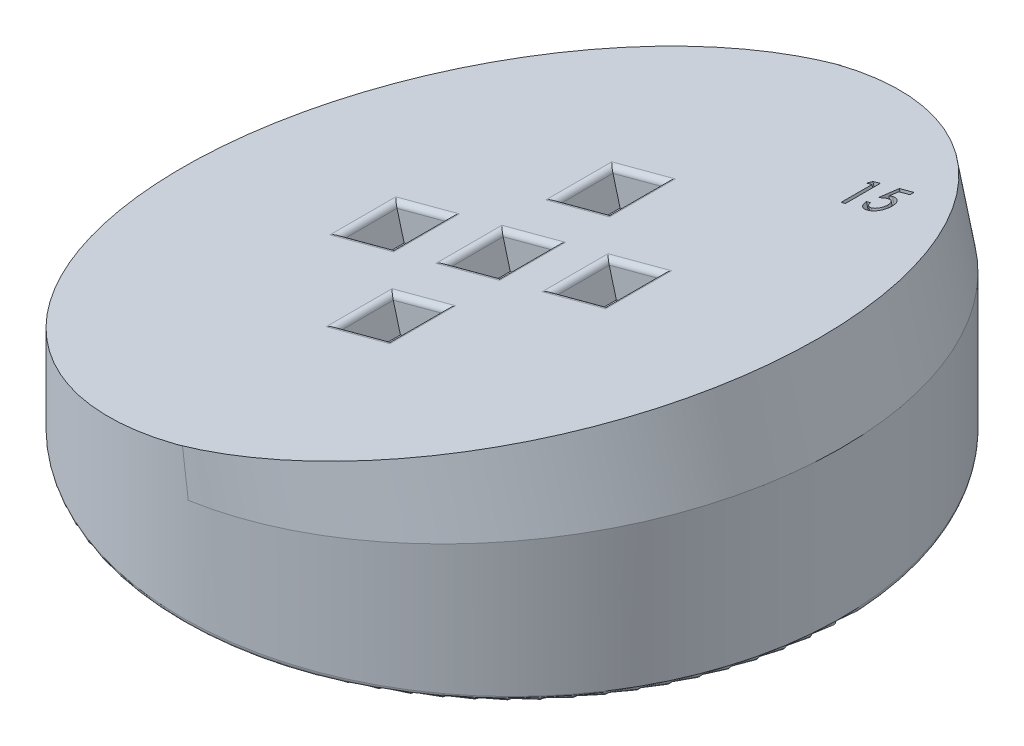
SolidWorks part; units mm, degrees
ref_plane "Front Plane" through (0, 0, 0) normal (0, 0, 1) x (1, 0, 0)
ref_plane "Top Plane" through (0, 0, 0) normal (0, 1, 0) x (1, 0, 0)
ref_plane "Right Plane" through (0, 0, 0) normal (1, 0, 0) x (0, 0, -1)
sketch "Sketch1" plane through (0, 0, 0) normal (0, 1, 0) x (1, 0, 0)
  circle A0 centre (0, 0) radius 30
extrude "Boss-Extrude1" add sketch "Sketch1" along normal blind 50
sketch "Sketch3" plane through (0, 50, 0) normal (0, 1, 0) x (1, 0, 0)
sketch "Sketch4" plane through (0, 0, 0) normal (0, -1, 0) x (-1, 0, 0)
  line L0 (0, 0) -> (-10, 0) construction
  line L1 (0, 0) -> (0, -10) construction
  line L2 (0, 0) -> (0, 10) construction
  line L3 (0, 0) -> (10, 0) construction
  line L5 (-2.5, 2.5) -> (2.5, 2.5)
  line L6 (-2.5, 2.5) -> (-2.5, -2.5)
  line L7 (-2.5, -2.5) -> (2.5, -2.5)
  line L8 (2.5, 2.5) -> (2.5, -2.5)
  line L9 (-2.5, 2.5) -> (2.5, -2.5) construction
  line L10 (-2.5, -2.5) -> (2.5, 2.5) construction
  line L11 (-2.5, -7.5) -> (2.5, -7.5)
  line L12 (-2.5, -7.5) -> (-2.5, -12.5)
  line L13 (-2.5, -12.5) -> (2.5, -12.5)
  line L14 (2.5, -7.5) -> (2.5, -12.5)
  line L15 (-2.5, -7.5) -> (2.5, -12.5) construction
  line L16 (-2.5, -12.5) -> (2.5, -7.5) construction
  line L17 (7.5, 2.5) -> (12.5, 2.5)
  line L18 (7.5, 2.5) -> (7.5, -2.5)
  line L19 (7.5, -2.5) -> (12.5, -2.5)
  line L20 (12.5, 2.5) -> (12.5, -2.5)
  line L21 (7.5, 2.5) -> (12.5, -2.5) construction
  line L22 (7.5, -2.5) -> (12.5, 2.5) construction
  line L23 (-12.5, 2.5) -> (-7.5, 2.5)
  line L24 (-12.5, 2.5) -> (-12.5, -2.5)
  line L25 (-12.5, -2.5) -> (-7.5, -2.5)
  line L26 (-7.5, 2.5) -> (-7.5, -2.5)
  line L27 (-12.5, 2.5) -> (-7.5, -2.5) construction
  line L28 (-12.5, -2.5) -> (-7.5, 2.5) construction
  line L29 (2.5, 7.5) -> (-2.5, 7.5)
  line L30 (2.5, 7.5) -> (2.5, 12.5)
  line L31 (2.5, 12.5) -> (-2.5, 12.5)
  line L32 (-2.5, 7.5) -> (-2.5, 12.5)
  line L33 (2.5, 7.5) -> (-2.5, 12.5) construction
  line L34 (2.5, 12.5) -> (-2.5, 7.5) construction
  dimension "D1" = 5
  dimension "D2" = 5
  dimension "D3" = 5
  dimension "D4" = 5
  dimension "D5" = 5
  dimension "D6" = 5
extrude "Cut-Extrude2" cut sketch "Sketch4" against normal blind 3
fillet "Fillet2" radius 0.5 21 edges at (0, 0, 30) (2.5, 0, 0) (0, 0, 2.5) (-2.5, 0, 0) (0, 0, -2.5) (2.5, 0, 10) (0, 0, 12.5) (-2.5, 0, 10) (0, 0, 7.5) (-7.5, 0, 0) (-10, 0, 2.5) (-12.5, 0, 0) (-10, 0, -2.5) (12.5, 0, 0) (10, 0, 2.5) (7.5, 0, 0) (10, 0, -2.5) (-2.5, 0, -10) (0, 0, -12.5) (2.5, 0, -10) (0, 0, -7.5)
ref_plane "Plane6" through (0, 0, 3.5) normal (0, 0, 1) x (1, 0, 0)
sketch "Sketch13" plane through (0, 0, 3.5) normal (0, 0, 1) x (1, 0, 0)
  line L0 (-30, 6) -> (30, 22.077)
  line L1 (-30, 50) -> (-30, 0.5) construction
  line L2 (30, 0.5) -> (30, 50) construction
  line L3 (30, 22.077) -> (30, 50)
  line L4 (30, 50) -> (-30, 50)
  line L5 (-30, 50) -> (-30, 6)
  line L6 (30, 0.5) -> (-30, 0.5) construction
  dimension "D1" = 5.5
  dimension "D2" = 15
extrude "Cut-Extrude10" cut sketch "Sketch13" against normal mid plane 90
ref_plane "Plane4" through (0, 0, -2.5) normal (0, 0, -1) x (-1, 0, 0)
ref_plane "Plane5" through (0, 0, -62.5) normal (0, 0, -1) x (-1, 0, 0)
sketch "Sketch15" plane through (-3.5096, 13.0981, 0) normal (-0.2588, 0.9659, 0) x (0.9659, 0.2588, 0)
  line L0 (-27.4249, 0) -> (0, 0) construction
  line L2 (-4.9249, -2.5) -> (-9.9249, -2.5)
  line L3 (-4.9249, -2.5) -> (-4.9249, 2.5)
  line L4 (-4.9249, 2.5) -> (-9.9249, 2.5)
  line L5 (-9.9249, -2.5) -> (-9.9249, 2.5)
  line L6 (-4.9249, -2.5) -> (-9.9249, 2.5) construction
  line L7 (-4.9249, 2.5) -> (-9.9249, -2.5) construction
  line L8 (5.0751, -2.5) -> (0.0751, -2.5)
  line L9 (5.0751, -2.5) -> (5.0751, 2.5)
  line L10 (5.0751, 2.5) -> (0.0751, 2.5)
  line L11 (0.0751, -2.5) -> (0.0751, 2.5)
  line L12 (5.0751, -2.5) -> (0.0751, 2.5) construction
  line L13 (5.0751, 2.5) -> (0.0751, -2.5) construction
  line L14 (15.0751, -2.5) -> (10.0751, -2.5)
  line L15 (15.0751, -2.5) -> (15.0751, 2.5)
  line L16 (15.0751, 2.5) -> (10.0751, 2.5)
  line L17 (10.0751, -2.5) -> (10.0751, 2.5)
  line L18 (15.0751, -2.5) -> (10.0751, 2.5) construction
  line L19 (15.0751, 2.5) -> (10.0751, -2.5) construction
  line L20 (5.0751, -12.5) -> (0.0751, -12.5)
  line L21 (5.0751, -12.5) -> (5.0751, -7.5)
  line L22 (5.0751, -7.5) -> (0.0751, -7.5)
  line L23 (0.0751, -12.5) -> (0.0751, -7.5)
  line L24 (5.0751, -12.5) -> (0.0751, -7.5) construction
  line L25 (5.0751, -7.5) -> (0.0751, -12.5) construction
  line L26 (5.0751, 7.5) -> (0.0751, 7.5)
  line L27 (5.0751, 7.5) -> (5.0751, 12.5)
  line L28 (5.0751, 12.5) -> (0.0751, 12.5)
  line L29 (0.0751, 7.5) -> (0.0751, 12.5)
  line L30 (5.0751, 7.5) -> (0.0751, 12.5) construction
  line L31 (5.0751, 12.5) -> (0.0751, 7.5) construction
  ellipse E0 centre (3.6334, 0) end of major axis (-27.4249, 0) minor radius 30 construction
  point P9 (-7.4249, 0)
  point P14 (2.5751, 0)
  point P19 (12.5751, 0)
  point P24 (2.5751, -10)
  point P29 (2.5751, 10)
  dimension "D1" = 40
  dimension "D2" = 30
  dimension "D3" = 20
  dimension "D4" = 5
  dimension "D5" = 5
  dimension "D6" = 5
  dimension "D7" = 5
  dimension "D8" = 5
  dimension "D9" = 5
  dimension "D10" = 5
  dimension "D11" = 5
  dimension "D12" = 10
  dimension "D13" = 10
  dimension "D14" = 5
  dimension "D15" = 5
extrude "Cut-Extrude11" cut sketch "Sketch15" against normal blind 3
ref_plane "Plane7" through (0, 0, 0) normal (0, 0, -1) x (-1, 0, 0)
sketch "Sketch24" plane through (-3.5096, 13.0981, 0) normal (-0.2588, 0.9659, 0) x (0.9659, 0.2588, 0)
  line L0 (2.5751, -30) -> (35.1643, -35.8499)
  line L1 (2.5751, 0) -> (-27.4249, 0)
  line L3 (35.1643, -35.8499) -> (45.7239, 0)
  line L4 (45.7239, 0) -> (28.8644, 38.5482)
  line L5 (28.8644, 38.5482) -> (2.5751, 34.4662)
  line L6 (2.5751, 34.4662) -> (2.5751, 30)
  arc A0 (2.5751, -30) -> (-27.4249, 0) centre (2.5751, 0) ccw
  ellipse E1 centre (3.6334, 0) end of major axis (-27.4249, 0) minor radius 30 construction
  dimension "D1" = 30
extrude "Cut-Extrude13" cut sketch "Sketch24" against normal blind 100 contours A0 M21
fillet "Fillet8" radius 0.5 4 edges at (-1.0222, 13.7646, -7.5) (1.3926, 14.4116, -10) (-1.0222, 13.7646, -12.5) (-3.437, 13.1175, -10)
fillet "Fillet9" radius 0.5 4 edges at (8.637, 16.3528, 2.5) (11.0518, 16.9998, 0) (8.637, 16.3528, -2.5) (6.2222, 15.7057, 0)
fillet "Fillet10" radius 0.5 4 edges at (-13.0963, 10.5293, 0) (-10.6815, 11.1764, 2.5) (-8.2667, 11.8234, 0) (-10.6815, 11.1764, -2.5)
fillet "Fillet11" radius 0.5 4 edges at (-3.437, 13.1175, 10) (-1.0222, 13.7646, 12.5) (1.3926, 14.4116, 10) (-1.0222, 13.7646, 7.5)
fillet "Fillet12" radius 0.5 4 edges at (-3.437, 13.1175, 0) (-1.0222, 13.7646, 2.5) (1.3926, 14.4116, 0) (-1.0222, 13.7646, -2.5)
sketch "Sketch25" plane through (-3.5096, 13.0981, 0) normal (-0.2588, 0.9659, 0) x (0.9659, 0.2588, 0)
  text T0 "<b>15</b>"
extrude "Cut-Extrude14" cut sketch "Sketch25" against normal blind 4
